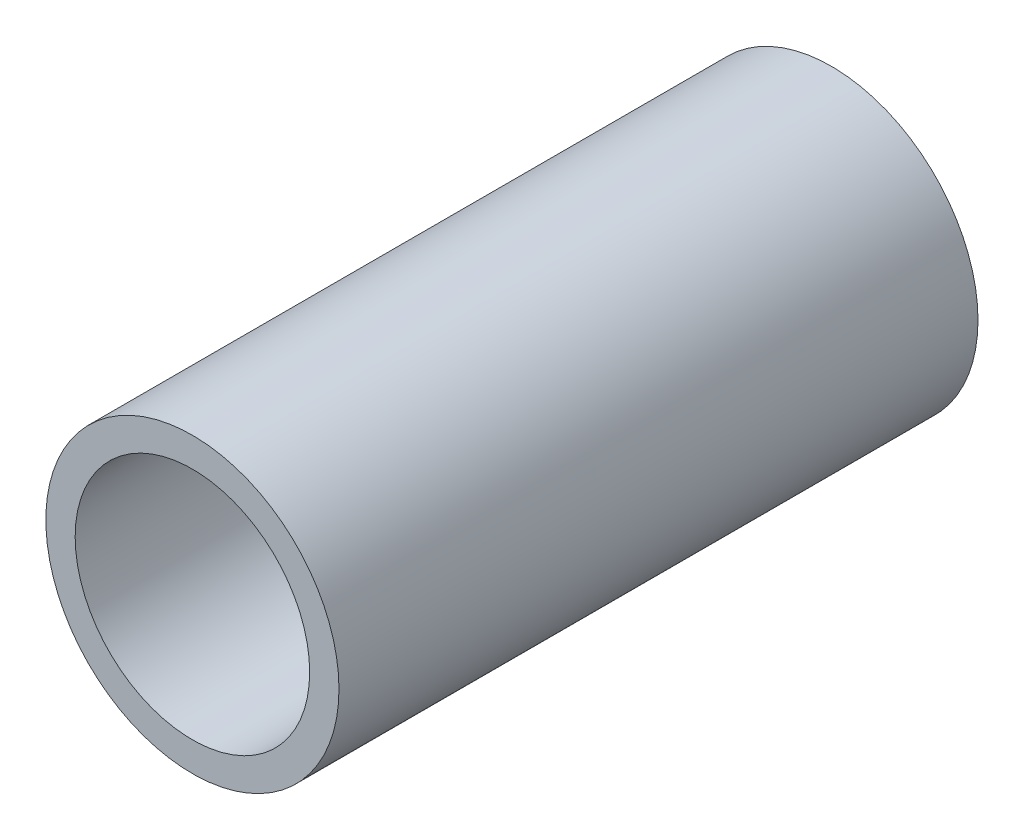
SolidWorks part; units mm, degrees
ref_plane "Plan de face" through (0, 0, 0) normal (0, 0, 1) x (1, 0, 0)
ref_plane "Plan de dessus" through (0, 0, 0) normal (0, 1, 0) x (1, 0, 0)
ref_plane "Plan de droite" through (0, 0, 0) normal (1, 0, 0) x (0, 0, -1)
sketch "Esquisse1" plane through (0, 0, 0) normal (0, 0, 1) x (1, 0, 0)
  circle A0 centre (0, 0) radius 20
  dimension "D1" = 40
extrude "Extru.-Mince1" add sketch "Esquisse1" along normal blind 109 thin
